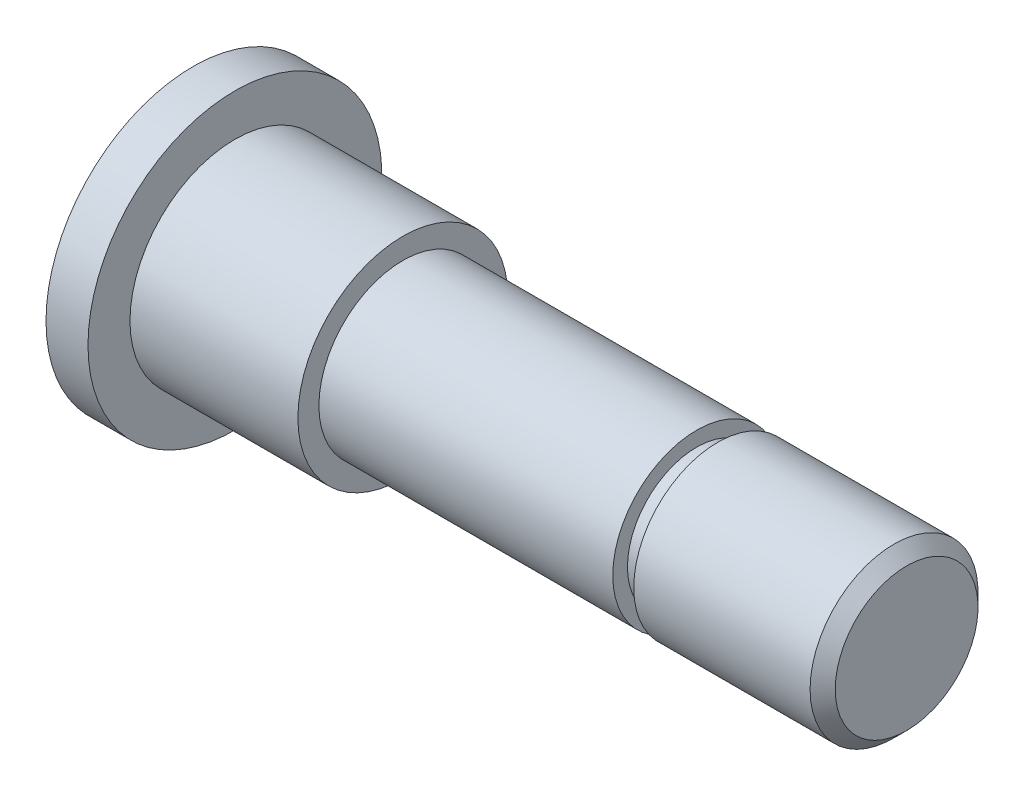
SolidWorks part; units mm, degrees
ref_plane "Plan1" through (0, 0, 0) normal (0, 0, 1) x (1, 0, 0)
ref_plane "Plan2" through (0, 0, 0) normal (0, 1, 0) x (1, 0, 0)
ref_plane "Plan3" through (0, 0, 0) normal (1, 0, 0) x (0, 0, -1)
sketch "Esquisse1" plane through (0, 0, 0) normal (0, 0, 1) x (1, 0, 0)
  line L0 (0, 0) -> (0, 7)
  line L1 (24, 4) -> (24, 3.3)
  line L2 (24, 3.3) -> (25, 3.3)
  line L3 (25, 3.3) -> (25, 4)
  line L4 (10, 5) -> (10, 4)
  line L5 (10, 4) -> (24, 4)
  line L6 (34, 4) -> (34, 0)
  line L7 (34, 0) -> (0, 0)
  line L8 (-12.5747, 0) -> (48.4041, 0) construction
  line L9 (0, 7) -> (2, 7)
  line L10 (2, 7) -> (2, 5)
  line L11 (2, 5) -> (10, 5)
  line L12 (25, 4) -> (34, 4)
  dimension "D1" = 2
  dimension "D2" = 7
  dimension "D3" = 4
  dimension "D4" = 5
  dimension "D5" = 0.7
  dimension "D6" = 24
  dimension "D7" = 1
  dimension "D8" = 8
  dimension "D9" = 14
revolve "Base-Révolution" add sketch "Esquisse1" angle 360 about L8
chamfer "Chanfrein1" distance 0.6 angle 45
